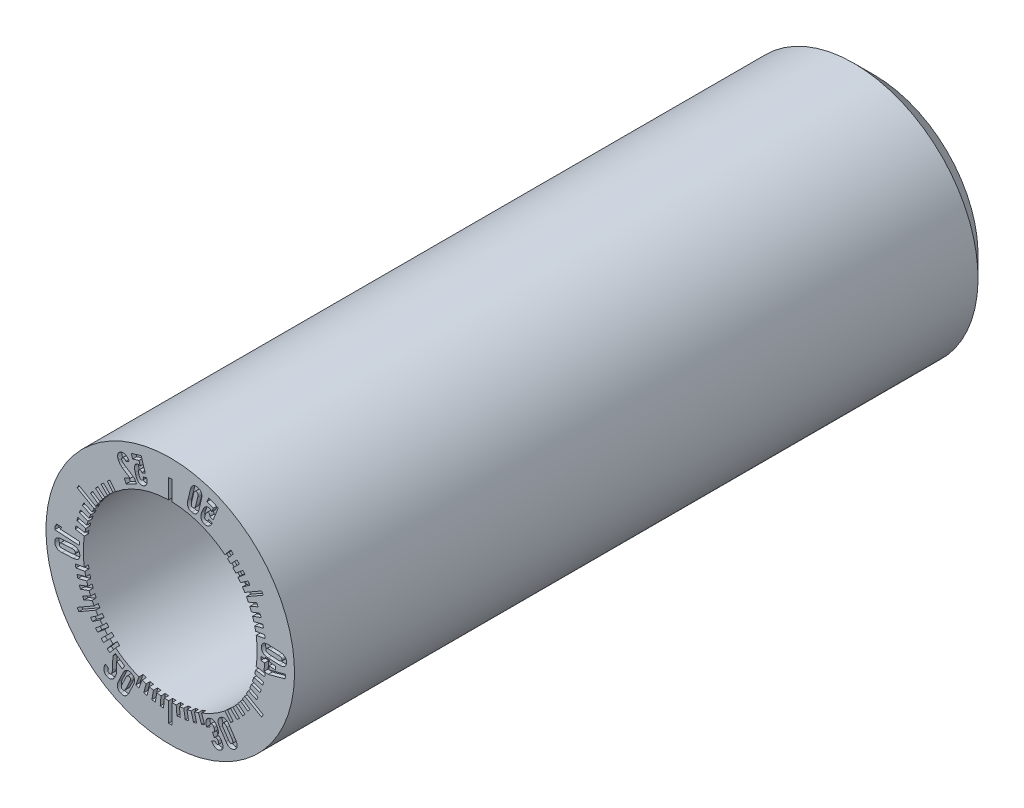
SolidWorks part; units mm, degrees
ref_plane "Front Plane" through (0, 0, 0) normal (0, 0, 1) x (1, 0, 0)
ref_plane "Top Plane" through (0, 0, 0) normal (0, 1, 0) x (1, 0, 0)
ref_plane "Right Plane" through (0, 0, 0) normal (1, 0, 0) x (0, 0, -1)
sketch "Sketch1" plane through (0, 0, 0) normal (1, 0, 0) x (0, 0, -1)
  line L0 (0, 0) -> (-75.4695, 0) construction
  line L2 (17, 1.5) -> (17, 2.5)
  line L4 (16.5, 3) -> (0, 3)
  line L5 (0, 3) -> (0, 2.1)
  line L7 (0, 2.1) -> (3, 2.1)
  line L8 (3, 2.1) -> (3, 0.8)
  line L9 (3, 0.8) -> (12, 0.8)
  line L10 (17, 1.5) -> (12, 1.5)
  line L11 (12, 0.8) -> (12, 1.5)
  line L12 (17, 2.5) -> (16.5, 3)
  point P6 (17, 3)
  dimension "D1" = 17
  dimension "D2" = 6
  dimension "D3" = 4.2
  dimension "D4" = 3
  dimension "D5" = 1.6
  dimension "D6" = 3
  dimension "D7" = 5
revolve "Revolve1" add sketch "Sketch1" angle 360 about L0
sketch "Sketch2" plane through (0, 0, 0) normal (0, 0, 1) x (1, 0, 0)
  line L0 (0, 0) -> (0, 3.6797) construction
  line L1 (2.2057, 1.3196) -> (2.2457, 1.2504)
  line L2 (-0.04, 2.57) -> (0.04, 2.57)
  line L3 (-0.04, 2.57) -> (-0.04, 2.09)
  line L4 (-0.04, 2.09) -> (0.04, 2.09)
  line L5 (0.04, 2.57) -> (0.04, 2.09)
  line L6 (2.2457, 1.2504) -> (1.83, 1.0104)
  line L7 (2.2057, 1.3196) -> (1.79, 1.0796)
  line L8 (1.79, 1.0796) -> (1.83, 1.0104)
  line L9 (-0.222, -2.0786) -> (-0.1423, -2.0855)
  line L10 (-0.1423, -2.0855) -> (-0.1624, -2.3147)
  line L11 (-0.222, -2.0786) -> (-0.242, -2.3077)
  line L12 (-0.242, -2.3077) -> (-0.1624, -2.3147)
  line L13 (2.2457, -1.2504) -> (2.2057, -1.3196)
  line L14 (2.2057, -1.3196) -> (1.79, -1.0796)
  line L15 (2.2457, -1.2504) -> (1.83, -1.0104)
  line L16 (1.83, -1.0104) -> (1.79, -1.0796)
  line L17 (0.04, -2.57) -> (-0.04, -2.57)
  line L18 (-0.04, -2.57) -> (-0.04, -2.09)
  line L19 (0.04, -2.57) -> (0.04, -2.09)
  line L20 (0.04, -2.09) -> (-0.04, -2.09)
  line L21 (-0.4023, -2.0513) -> (-0.3235, -2.0652)
  line L22 (-2.2057, -1.3196) -> (-2.2457, -1.2504)
  line L23 (-2.2457, -1.2504) -> (-1.83, -1.0104)
  line L24 (-2.2057, -1.3196) -> (-1.79, -1.0796)
  line L25 (-1.79, -1.0796) -> (-1.83, -1.0104)
  line L26 (-0.3235, -2.0652) -> (-0.3635, -2.2917)
  line L27 (-0.4023, -2.0513) -> (-0.4423, -2.2778)
  line L28 (-0.4423, -2.2778) -> (-0.3635, -2.2917)
  line L29 (-0.5796, -2.0084) -> (-0.5023, -2.0291)
  line L30 (-0.5023, -2.0291) -> (-0.5618, -2.2513)
  line L31 (-0.5796, -2.0084) -> (-0.6391, -2.2306)
  line L32 (-0.6391, -2.2306) -> (-0.5618, -2.2513)
  line L33 (-2.2457, 1.2504) -> (-2.2057, 1.3196)
  line L34 (-2.2057, 1.3196) -> (-1.79, 1.0796)
  line L35 (-0.7524, -1.9503) -> (-0.6772, -1.9776)
  line L36 (-0.6772, -1.9776) -> (-0.7559, -2.1938)
  line L37 (-0.7524, -1.9503) -> (-0.8311, -2.1664)
  line L38 (-0.8311, -2.1664) -> (-0.7559, -2.1938)
  line L39 (1.0126, 2.1395) -> (1.0127, 2.1398)
  line L40 (1.0127, 2.1398) -> (0.9315, 2.1728)
  line L41 (0.9315, 2.1728) -> (0.9313, 2.1724)
  line L42 (0.8419, 2.2135) -> (0.8605, 2.2593)
  line L43 (0.9573, 2.2485) -> (1.0332, 2.2176)
  line L44 (1.0332, 2.2176) -> (1.1606, 2.5315)
  line L45 (1.1606, 2.5315) -> (0.929, 2.6256)
  line L46 (0.929, 2.6256) -> (0.8888, 2.5265)
  line L47 (0.8888, 2.5265) -> (1.0392, 2.4654)
  line L48 (1.0392, 2.4654) -> (1, 2.3689)
  line L49 (0.7792, 2.2924) -> (0.7606, 2.2466)
  line L50 (0.6917, 2.2546) -> (0.7551, 2.5155)
  line L51 (-2.2457, 1.2504) -> (-1.83, 1.0104)
  line L52 (-1.3741, -1.5753) -> (-1.3128, -1.6267)
  line L53 (-1.3128, -1.6267) -> (-1.4606, -1.8029)
  line L54 (-1.3741, -1.5753) -> (-1.5219, -1.7515)
  line L55 (-1.5219, -1.7515) -> (-1.4606, -1.8029)
  line L56 (-1.5061, -1.4496) -> (-1.4496, -1.5061)
  line L57 (-1.4496, -1.5061) -> (-1.6122, -1.6688)
  line L58 (-1.5061, -1.4496) -> (-1.6688, -1.6122)
  line L59 (-1.6688, -1.6122) -> (-1.6122, -1.6688)
  line L60 (-1.6267, -1.3128) -> (-1.5753, -1.3741)
  line L61 (-1.5753, -1.3741) -> (-1.7515, -1.5219)
  line L62 (-1.6267, -1.3128) -> (-1.8029, -1.4606)
  line L63 (-1.8029, -1.4606) -> (-1.7515, -1.5219)
  line L64 (-1.735, -1.166) -> (-1.6891, -1.2315)
  line L65 (-1.6891, -1.2315) -> (-1.8775, -1.3635)
  line L66 (-1.735, -1.166) -> (-1.9234, -1.2979)
  line L67 (-1.9234, -1.2979) -> (-1.8775, -1.3635)
  line L68 (-1.83, 1.0104) -> (-1.79, 1.0796)
  line L69 (0.4869, 2.5806) -> (0.4235, 2.3197)
  line L70 (0.5149, 2.3269) -> (0.5648, 2.5325)
  line L71 (0.664, 2.5083) -> (0.6141, 2.3028)
  line L72 (-1.9111, -0.847) -> (-1.8773, -0.9195)
  line L73 (-1.8773, -0.9195) -> (-2.0857, -1.0167)
  line L74 (-1.9111, -0.847) -> (-2.1195, -0.9442)
  line L75 (-2.1195, -0.9442) -> (-2.0857, -1.0167)
  line L76 (-1.9776, -0.6772) -> (-1.9503, -0.7524)
  line L77 (-1.9503, -0.7524) -> (-2.1664, -0.8311)
  line L78 (-1.9776, -0.6772) -> (-2.1938, -0.7559)
  line L79 (-2.1938, -0.7559) -> (-2.1664, -0.8311)
  line L80 (-2.0291, -0.5023) -> (-2.0084, -0.5796)
  line L81 (-2.0084, -0.5796) -> (-2.2306, -0.6391)
  line L82 (-2.0291, -0.5023) -> (-2.2513, -0.5618)
  line L83 (-2.2513, -0.5618) -> (-2.2306, -0.6391)
  line L84 (-2.0652, -0.3235) -> (-2.0513, -0.4023)
  line L85 (-2.0513, -0.4023) -> (-2.2778, -0.4423)
  line L86 (-2.0652, -0.3235) -> (-2.2917, -0.3635)
  line L87 (-2.2917, -0.3635) -> (-2.2778, -0.4423)
  line L88 (-0.5693, 2.2975) -> (-0.5694, 2.2979)
  line L89 (-0.5694, 2.2979) -> (-0.6529, 2.2721)
  line L90 (-0.6529, 2.2721) -> (-0.6528, 2.2718)
  line L91 (-0.7476, 2.247) -> (-0.7621, 2.2943)
  line L92 (-0.6806, 2.347) -> (-0.6027, 2.3711)
  line L93 (-0.6027, 2.3711) -> (-0.7026, 2.6947)
  line L94 (-0.7026, 2.6947) -> (-0.9404, 2.6213)
  line L95 (-0.9404, 2.6213) -> (-0.9088, 2.5191)
  line L96 (-0.9088, 2.5191) -> (-0.7545, 2.5668)
  line L97 (-0.7545, 2.5668) -> (-0.7238, 2.4673)
  line L98 (-0.8454, 2.2685) -> (-0.8309, 2.2212)
  line L99 (-0.8568, 2.1323) -> (-1.1152, 2.3059)
  line L100 (-2.0513, 0.4023) -> (-2.0652, 0.3235)
  line L101 (-2.0652, 0.3235) -> (-2.2917, 0.3635)
  line L102 (-2.0513, 0.4023) -> (-2.2778, 0.4423)
  line L103 (-2.2778, 0.4423) -> (-2.2917, 0.3635)
  line L104 (-2.0084, 0.5796) -> (-2.0291, 0.5023)
  line L105 (-2.0291, 0.5023) -> (-2.2513, 0.5618)
  line L106 (-2.0084, 0.5796) -> (-2.2306, 0.6391)
  line L107 (-2.2306, 0.6391) -> (-2.2513, 0.5618)
  line L108 (-1.9503, 0.7524) -> (-1.9776, 0.6772)
  line L109 (-1.9776, 0.6772) -> (-2.1938, 0.7559)
  line L110 (-1.9503, 0.7524) -> (-2.1664, 0.8311)
  line L111 (-2.1664, 0.8311) -> (-2.1938, 0.7559)
  line L112 (-1.8773, 0.9195) -> (-1.9111, 0.847)
  line L113 (-1.9111, 0.847) -> (-2.1195, 0.9442)
  line L114 (-1.8773, 0.9195) -> (-2.0857, 1.0167)
  line L115 (-2.0857, 1.0167) -> (-2.1195, 0.9442)
  line L116 (-1.1664, 2.3616) -> (-1.1667, 2.3624)
  line L117 (-1.0696, 2.3864) -> (-1.0694, 2.3861)
  line L118 (-1.0694, 2.3861) -> (-0.9881, 2.4245)
  line L119 (-0.9881, 2.4245) -> (-0.9883, 2.4248)
  line L120 (-1.6891, 1.2315) -> (-1.735, 1.166)
  line L121 (-1.735, 1.166) -> (-1.9234, 1.2979)
  line L122 (-1.6891, 1.2315) -> (-1.8775, 1.3635)
  line L123 (-1.8775, 1.3635) -> (-1.9234, 1.2979)
  line L124 (-1.5753, 1.3741) -> (-1.6267, 1.3128)
  line L125 (-1.6267, 1.3128) -> (-1.8029, 1.4606)
  line L126 (-1.5753, 1.3741) -> (-1.7515, 1.5219)
  line L127 (-1.7515, 1.5219) -> (-1.8029, 1.4606)
  line L128 (-1.4496, 1.5061) -> (-1.5061, 1.4496)
  line L129 (0, 0) -> (0, -3.2841) construction
  line L130 (-1.5061, 1.4496) -> (-1.6688, 1.6122)
  line L131 (-1.4496, 1.5061) -> (-1.6122, 1.6688)
  line L132 (-1.6122, 1.6688) -> (-1.6688, 1.6122)
  line L133 (-1.3128, 1.6267) -> (-1.3741, 1.5753)
  line L134 (-1.3741, 1.5753) -> (-1.5219, 1.7515)
  line L135 (-1.3128, 1.6267) -> (-1.4606, 1.8029)
  line L136 (-1.4606, 1.8029) -> (-1.5219, 1.7515)
  line L137 (-1.2498, 2.3267) -> (-1.2496, 2.3264)
  line L138 (-1.1469, 2.2068) -> (-0.9649, 2.0892)
  line L139 (-0.9649, 2.0892) -> (-1.1087, 2.0213)
  line L140 (-1.1087, 2.0213) -> (-1.0628, 1.9241)
  line L141 (-1.0628, 1.9241) -> (-0.8139, 2.0413)
  line L142 (-0.8139, 2.0413) -> (-0.8568, 2.1323)
  line L143 (-2.1971, 0.0682) -> (-2.192, 0.1557)
  line L144 (-2.192, 0.1557) -> (-2.6514, 0.1825)
  line L145 (-2.6514, 0.1825) -> (-2.6208, 0.2374)
  line L146 (-2.6208, 0.2374) -> (-2.739, 0.2443)
  line L147 (-2.739, 0.2443) -> (-2.7828, 0.1773)
  line L148 (-2.7828, 0.1773) -> (-2.7871, 0.1025)
  line L149 (-2.7871, 0.1025) -> (-2.1971, 0.0682)
  line L150 (-2.3583, 0.0059) -> (-2.6266, -0.0094)
  line L151 (-2.6109, -0.2872) -> (-2.3426, -0.272)
  line L152 (-2.3761, -0.1861) -> (-2.5874, -0.1981)
  line L153 (-2.5933, -0.0953) -> (-2.3819, -0.0833)
  line L154 (-1.3836, -1.8346) -> (-1.398, -2.1453)
  line L155 (-1.4189, -2.2178) -> (-1.4193, -2.2183)
  line L156 (-1.4905, -2.1476) -> (-1.4902, -2.1472)
  line L157 (-1.4902, -2.1472) -> (-1.5653, -2.0974)
  line L158 (-1.5653, -2.0974) -> (-1.5655, -2.0978)
  line L159 (-1.3459, -2.2712) -> (-1.3456, -2.2708)
  line L160 (-1.2967, -2.1213) -> (-1.2906, -1.9048)
  line L161 (-1.2906, -1.9048) -> (-1.1579, -1.9931)
  line L162 (-1.1579, -1.9931) -> (-1.0984, -1.9036)
  line L163 (-1.0984, -1.9036) -> (-1.328, -1.7509)
  line L164 (-1.328, -1.7509) -> (-1.3836, -1.8346)
  line L165 (-1.1383, -2.0643) -> (-1.2534, -2.3052)
  line L166 (-1.0018, -2.4254) -> (-0.8868, -2.1845)
  line L167 (-0.9781, -2.1723) -> (-1.0688, -2.3621)
  line L168 (-1.162, -2.3176) -> (-1.0713, -2.1278)
  line L169 (0.8771, -2.1869) -> (0.959, -2.1478)
  line L170 (1.0548, -2.1131) -> (1.0607, -2.1255)
  line L171 (1.0524, -2.207) -> (1.0168, -2.224)
  line L172 (1.0168, -2.224) -> (1.0629, -2.3201)
  line L173 (1.0629, -2.3201) -> (1.0984, -2.3031)
  line L174 (1.156, -2.3426) -> (1.1604, -2.3517)
  line L175 (1.079, -2.3813) -> (0.9974, -2.4204)
  line L176 (1.2502, -2.3213) -> (1.2426, -2.3053)
  line L177 (1.142, -2.0772) -> (1.1344, -2.0612)
  line L178 (1.1933, -2.0345) -> (1.3428, -2.2582)
  line L179 (1.5751, -2.1029) -> (1.4257, -1.8792)
  line L180 (1.3683, -1.9518) -> (1.4862, -2.1282)
  line L181 (1.4001, -2.1857) -> (1.2823, -2.0093)
  line L182 (2.3652, -0.3458) -> (2.7739, -0.2354)
  line L183 (2.7739, -0.2354) -> (2.7821, -0.1363)
  line L184 (2.7821, -0.1363) -> (2.3786, -0.2433)
  line L185 (2.3786, -0.2433) -> (2.3855, -0.1588)
  line L186 (2.3957, -0.0348) -> (2.2886, -0.026)
  line L187 (2.2886, -0.026) -> (2.2856, -0.0624)
  line L188 (2.263, -0.3375) -> (2.3652, -0.3458)
  line L189 (2.5349, -0.1711) -> (2.5421, -0.0836)
  line L190 (2.5421, -0.0836) -> (2.3927, -0.0713)
  line L191 (2.1947, -0.0549) -> (2.1875, -0.1425)
  line L192 (2.1875, -0.1425) -> (2.2784, -0.15)
  line L193 (2.3636, -0.0013) -> (2.6325, -0.0147)
  line L194 (2.6464, 0.2638) -> (2.3776, 0.2772)
  line L195 (2.4017, 0.1881) -> (2.6136, 0.1774)
  line L196 (2.6085, 0.0744) -> (2.3966, 0.0851)
  line L197 (1.3741, 1.5753) -> (1.3128, 1.6267)
  line L198 (1.3128, 1.6267) -> (1.4606, 1.8029)
  line L199 (1.3741, 1.5753) -> (1.5219, 1.7515)
  line L200 (1.5219, 1.7515) -> (1.4606, 1.8029)
  line L201 (1.5061, 1.4496) -> (1.4496, 1.5061)
  line L202 (1.4496, 1.5061) -> (1.6122, 1.6688)
  line L203 (1.5061, 1.4496) -> (1.6688, 1.6122)
  line L204 (1.6688, 1.6122) -> (1.6122, 1.6688)
  line L205 (1.6267, 1.3128) -> (1.5753, 1.3741)
  line L206 (1.5753, 1.3741) -> (1.7515, 1.5219)
  line L207 (1.6267, 1.3128) -> (1.8029, 1.4606)
  line L208 (1.8029, 1.4606) -> (1.7515, 1.5219)
  line L209 (1.735, 1.166) -> (1.6891, 1.2315)
  line L210 (1.6891, 1.2315) -> (1.8775, 1.3635)
  line L211 (1.735, 1.166) -> (1.9234, 1.2979)
  line L212 (1.9234, 1.2979) -> (1.8775, 1.3635)
  line L213 (2.2856, -0.0624) -> (2.1947, -0.0549)
  line L214 (2.2784, -0.15) -> (2.263, -0.3375)
  line L215 (2.3927, -0.0713) -> (2.3957, -0.0348)
  line L216 (2.3855, -0.1588) -> (2.5349, -0.1711)
  line L217 (1.9111, 0.847) -> (1.8773, 0.9195)
  line L218 (1.8773, 0.9195) -> (2.0857, 1.0167)
  line L219 (1.9111, 0.847) -> (2.1195, 0.9442)
  line L220 (2.1195, 0.9442) -> (2.0857, 1.0167)
  line L221 (1.9776, 0.6772) -> (1.9503, 0.7524)
  line L222 (1.9503, 0.7524) -> (2.1664, 0.8311)
  line L223 (1.9776, 0.6772) -> (2.1938, 0.7559)
  line L224 (2.1938, 0.7559) -> (2.1664, 0.8311)
  line L225 (2.0291, 0.5023) -> (2.0084, 0.5796)
  line L226 (2.0084, 0.5796) -> (2.2306, 0.6391)
  line L227 (2.0291, 0.5023) -> (2.2513, 0.5618)
  line L228 (2.2513, 0.5618) -> (2.2306, 0.6391)
  line L229 (2.0652, 0.3235) -> (2.0513, 0.4023)
  line L230 (2.0513, 0.4023) -> (2.2778, 0.4423)
  line L231 (2.0652, 0.3235) -> (2.2917, 0.3635)
  line L232 (2.2917, 0.3635) -> (2.2778, 0.4423)
  line L245 (2.0513, -0.4023) -> (2.0652, -0.3235)
  line L246 (2.0652, -0.3235) -> (2.2917, -0.3635)
  line L247 (2.0513, -0.4023) -> (2.2778, -0.4423)
  line L248 (2.2778, -0.4423) -> (2.2917, -0.3635)
  line L249 (2.0084, -0.5796) -> (2.0291, -0.5023)
  line L250 (2.0291, -0.5023) -> (2.2513, -0.5618)
  line L251 (2.0084, -0.5796) -> (2.2306, -0.6391)
  line L252 (2.2306, -0.6391) -> (2.2513, -0.5618)
  line L253 (1.9503, -0.7524) -> (1.9776, -0.6772)
  line L254 (1.9776, -0.6772) -> (2.1938, -0.7559)
  line L255 (1.9503, -0.7524) -> (2.1664, -0.8311)
  line L256 (2.1664, -0.8311) -> (2.1938, -0.7559)
  line L257 (1.8773, -0.9195) -> (1.9111, -0.847)
  line L258 (1.9111, -0.847) -> (2.1195, -0.9442)
  line L259 (1.8773, -0.9195) -> (2.0857, -1.0167)
  line L260 (2.0857, -1.0167) -> (2.1195, -0.9442)
  line L265 (1.6891, -1.2315) -> (1.735, -1.166)
  line L266 (1.735, -1.166) -> (1.9234, -1.2979)
  line L267 (1.6891, -1.2315) -> (1.8775, -1.3635)
  line L268 (1.8775, -1.3635) -> (1.9234, -1.2979)
  line L269 (1.5753, -1.3741) -> (1.6267, -1.3128)
  line L270 (1.6267, -1.3128) -> (1.8029, -1.4606)
  line L271 (1.5753, -1.3741) -> (1.7515, -1.5219)
  line L272 (1.7515, -1.5219) -> (1.8029, -1.4606)
  line L273 (1.4496, -1.5061) -> (1.5061, -1.4496)
  line L274 (1.5061, -1.4496) -> (1.6688, -1.6122)
  line L275 (1.4496, -1.5061) -> (1.6122, -1.6688)
  line L276 (1.6122, -1.6688) -> (1.6688, -1.6122)
  line L277 (1.3128, -1.6267) -> (1.3741, -1.5753)
  line L278 (1.3741, -1.5753) -> (1.5219, -1.7515)
  line L279 (1.3128, -1.6267) -> (1.4606, -1.8029)
  line L280 (1.4606, -1.8029) -> (1.5219, -1.7515)
  line L293 (0.6772, -1.9776) -> (0.7524, -1.9503)
  line L294 (0.7524, -1.9503) -> (0.8311, -2.1664)
  line L295 (0.6772, -1.9776) -> (0.7559, -2.1938)
  line L296 (0.7559, -2.1938) -> (0.8311, -2.1664)
  line L297 (0.5023, -2.0291) -> (0.5796, -2.0084)
  line L298 (0.5796, -2.0084) -> (0.6391, -2.2306)
  line L299 (0.5023, -2.0291) -> (0.5618, -2.2513)
  line L300 (0.5618, -2.2513) -> (0.6391, -2.2306)
  line L301 (0.3235, -2.0652) -> (0.4023, -2.0513)
  line L302 (0.4023, -2.0513) -> (0.4423, -2.2778)
  line L303 (0.3235, -2.0652) -> (0.3635, -2.2917)
  line L304 (0.3635, -2.2917) -> (0.4423, -2.2778)
  line L305 (0.1423, -2.0855) -> (0.222, -2.0786)
  line L306 (0.222, -2.0786) -> (0.242, -2.3077)
  line L307 (0.1423, -2.0855) -> (0.1624, -2.3147)
  line L308 (0.1624, -2.3147) -> (0.242, -2.3077)
  circle A0 centre (0, 0) radius 2.2 construction
  spline S0 degree 3 poles (0.8198, 2.0274) (0.8309, 2.0229) (0.8485, 2.0183) (0.8725, 2.0184) (0.8904, 2.0209) (0.9081, 2.0263) (0.9253, 2.0348) (0.942, 2.0459) (0.9581, 2.0597) (0.9734, 2.0761) (0.9931, 2.102) (1.0054, 2.1239) (1.0126, 2.1395) knots 0 0 0 0 0.145629 0.217085 0.289467 0.363823 0.440349 0.520959 0.606365 0.696725 0.792102 1 1 1 1
  spline S1 degree 3 poles (0.9313, 2.1724) (0.9271, 2.1636) (0.9195, 2.1518) (0.9075, 2.1384) (0.8982, 2.1314) (0.8886, 2.1265) (0.8753, 2.1236) (0.8652, 2.1252) (0.8591, 2.1278) knots 0 0 0 0 0.312991 0.44747 0.570627 0.68364 0.788056 1 1 1 1
  spline S2 degree 3 poles (0.8591, 2.1278) (0.8526, 2.1304) (0.8437, 2.1365) (0.8362, 2.1485) (0.8329, 2.159) (0.8317, 2.171) (0.8335, 2.1897) (0.838, 2.2039) (0.8419, 2.2135) knots 0 0 0 0 0.214624 0.317977 0.427535 0.5492 0.682312 1 1 1 1
  spline S3 degree 3 poles (0.8605, 2.2593) (0.8644, 2.2688) (0.8707, 2.2823) (0.8821, 2.297) (0.8907, 2.305) (0.8997, 2.3103) (0.9122, 2.3144) (0.9221, 2.3128) (0.9279, 2.3104) knots 0 0 0 0 0.329173 0.466162 0.588662 0.698351 0.798671 1 1 1 1
  spline S4 degree 3 poles (0.9279, 2.3104) (0.9335, 2.3083) (0.941, 2.3034) (0.949, 2.2947) (0.9534, 2.2869) (0.9565, 2.2783) (0.959, 2.2654) (0.9582, 2.2553) (0.9573, 2.2485) knots 0 0 0 0 0.240245 0.355023 0.473973 0.59586 0.722024 1 1 1 1
  spline S5 degree 3 poles (1, 2.3689) (0.9983, 2.374) (0.9949, 2.3815) (0.9882, 2.3905) (0.9822, 2.397) (0.9756, 2.4032) (0.9661, 2.41) (0.9585, 2.4143) (0.9532, 2.4164) knots 0 0 0 0 0.232907 0.35742 0.487452 0.620741 0.749919 1 1 1 1
  spline S6 degree 3 poles (0.9532, 2.4164) (0.9427, 2.4205) (0.9261, 2.4249) (0.9038, 2.424) (0.8876, 2.4204) (0.8718, 2.4141) (0.8566, 2.4047) (0.8419, 2.3925) (0.8278, 2.3776) (0.8144, 2.36) (0.7967, 2.3321) (0.7859, 2.3087) (0.7792, 2.2924) knots 0 0 0 0 0.14204 0.2102 0.278275 0.348606 0.422261 0.501581 0.586913 0.678872 0.778296 1 1 1 1
  spline S7 degree 3 poles (0.7606, 2.2466) (0.7542, 2.2301) (0.7456, 2.2057) (0.74, 2.1729) (0.7385, 2.1503) (0.7397, 2.1292) (0.7432, 2.1094) (0.7498, 2.0913) (0.7586, 2.0747) (0.7703, 2.0599) (0.7896, 2.0422) (0.8072, 2.0324) (0.8198, 2.0274) knots 0 0 0 0 0.207219 0.300939 0.388369 0.470617 0.547977 0.62217 0.694941 0.767315 0.841383 1 1 1 1
  spline S8 degree 3 poles (0.518, 2.1242) (0.5283, 2.1217) (0.5438, 2.1192) (0.5641, 2.1191) (0.5783, 2.1207) (0.5919, 2.1238) (0.6049, 2.1285) (0.617, 2.1351) (0.6286, 2.1429) (0.6394, 2.1524) (0.6493, 2.1632) (0.6585, 2.1752) (0.6669, 2.1886) (0.6745, 2.2032) (0.6834, 2.2251) (0.6888, 2.2425) (0.6917, 2.2546) knots 0 0 0 0 0.129288 0.189012 0.247001 0.302666 0.358203 0.413902 0.47038 0.528574 0.58769 0.648588 0.712173 0.778943 0.848882 1 1 1 1
  spline S9 degree 3 poles (0.7551, 2.5155) (0.7582, 2.5276) (0.7614, 2.5457) (0.7633, 2.5695) (0.7636, 2.586) (0.7621, 2.6017) (0.7596, 2.6166) (0.7556, 2.6307) (0.7502, 2.6439) (0.7436, 2.6562) (0.7356, 2.6675) (0.7263, 2.6776) (0.7157, 2.6866) (0.7037, 2.6943) (0.6858, 2.7037) (0.6709, 2.7083) (0.6606, 2.7109) knots 0 0 0 0 0.152555 0.222885 0.28958 0.353124 0.414338 0.473292 0.531017 0.587519 0.642883 0.698387 0.754422 0.811742 0.8712 1 1 1 1
  spline S10 degree 3 poles (0.6606, 2.7109) (0.6503, 2.7135) (0.6349, 2.7159) (0.6145, 2.7161) (0.6003, 2.7146) (0.5868, 2.7116) (0.5739, 2.7068) (0.5617, 2.7005) (0.5502, 2.6927) (0.5394, 2.6835) (0.5294, 2.6727) (0.5202, 2.6608) (0.512, 2.6473) (0.5043, 2.6326) (0.4953, 2.6104) (0.4897, 2.5929) (0.4869, 2.5806) knots 0 0 0 0 0.129149 0.189243 0.246495 0.302472 0.357262 0.412782 0.468771 0.525998 0.585182 0.646015 0.709492 0.776677 0.847027 1 1 1 1
  spline S11 degree 3 poles (0.4235, 2.3197) (0.4204, 2.3076) (0.4172, 2.2895) (0.4153, 2.2657) (0.415, 2.2492) (0.4166, 2.2335) (0.419, 2.2186) (0.4231, 2.2045) (0.4284, 2.1913) (0.4351, 2.179) (0.4431, 2.1677) (0.4523, 2.1576) (0.463, 2.1487) (0.4749, 2.1408) (0.4929, 2.1315) (0.5078, 2.1269) (0.518, 2.1242) knots 0 0 0 0 0.152562 0.222896 0.289594 0.353141 0.414357 0.473315 0.531042 0.587547 0.642914 0.69842 0.753874 0.811733 0.871194 1 1 1 1
  spline S12 degree 3 poles (0.5433, 2.2284) (0.5356, 2.2301) (0.5245, 2.2355) (0.515, 2.2484) (0.5106, 2.2602) (0.5086, 2.2741) (0.5087, 2.2968) (0.5118, 2.3146) (0.5149, 2.3269) knots 0 0 0 0 0.20655 0.305065 0.41083 0.531717 0.668533 1 1 1 1
  spline S13 degree 3 poles (0.5648, 2.5325) (0.5681, 2.5447) (0.5729, 2.5622) (0.5836, 2.5821) (0.5916, 2.5935) (0.601, 2.602) (0.6154, 2.6091) (0.6277, 2.6087) (0.6353, 2.6068) knots 0 0 0 0 0.331526 0.468441 0.588018 0.69456 0.793838 1 1 1 1
  spline S14 degree 3 poles (0.6353, 2.6068) (0.643, 2.6051) (0.6541, 2.5997) (0.6637, 2.5868) (0.6682, 2.5749) (0.6704, 2.5611) (0.6703, 2.5384) (0.6669, 2.5207) (0.664, 2.5083) knots 0 0 0 0 0.206444 0.305849 0.412345 0.532333 0.669078 1 1 1 1
  spline S15 degree 3 poles (0.6141, 2.3028) (0.6111, 2.2904) (0.6058, 2.2732) (0.5954, 2.253) (0.5871, 2.2417) (0.5778, 2.2331) (0.5632, 2.2264) (0.551, 2.2263) (0.5433, 2.2284) knots 0 0 0 0 0.331056 0.467727 0.588299 0.69466 0.793572 1 1 1 1
  spline S16 degree 3 poles (-0.647, 2.089) (-0.6355, 2.0925) (-0.6193, 2.1003) (-0.6006, 2.1152) (-0.5887, 2.1286) (-0.5784, 2.1439) (-0.5704, 2.1613) (-0.5645, 2.1804) (-0.5609, 2.2012) (-0.5594, 2.2236) (-0.5607, 2.2561) (-0.565, 2.2809) (-0.5693, 2.2975) knots 0 0 0 0 0.145227 0.216025 0.288648 0.362693 0.439093 0.519844 0.605224 0.695708 0.791338 1 1 1 1
  spline S17 degree 3 poles (-0.6528, 2.2718) (-0.6507, 2.2622) (-0.6485, 2.2483) (-0.6496, 2.2304) (-0.6523, 2.2191) (-0.6567, 2.2094) (-0.6649, 2.1986) (-0.6737, 2.1934) (-0.6801, 2.1916) knots 0 0 0 0 0.313998 0.448349 0.571081 0.683382 0.78855 1 1 1 1
  spline S18 degree 3 poles (-0.6801, 2.1916) (-0.6868, 2.1895) (-0.6976, 2.1885) (-0.7109, 2.1932) (-0.7201, 2.1992) (-0.7285, 2.2078) (-0.7391, 2.2233) (-0.7444, 2.2372) (-0.7476, 2.247) knots 0 0 0 0 0.215045 0.31761 0.428122 0.549158 0.68289 1 1 1 1
  spline S19 degree 3 poles (-0.7621, 2.2943) (-0.7651, 2.3042) (-0.7686, 2.3185) (-0.7691, 2.3371) (-0.7675, 2.3486) (-0.764, 2.3585) (-0.757, 2.3694) (-0.7484, 2.3744) (-0.7424, 2.3763) knots 0 0 0 0 0.329547 0.467152 0.589298 0.699294 0.798546 1 1 1 1
  spline S20 degree 3 poles (-0.7424, 2.3763) (-0.7368, 2.378) (-0.7279, 2.3793) (-0.7163, 2.3773) (-0.708, 2.3744) (-0.7001, 2.3697) (-0.6901, 2.3612) (-0.6841, 2.353) (-0.6806, 2.347) knots 0 0 0 0 0.239083 0.353494 0.471595 0.593169 0.719161 1 1 1 1
  spline S21 degree 3 poles (-0.7238, 2.4673) (-0.7281, 2.4705) (-0.7357, 2.4736) (-0.7464, 2.4768) (-0.7552, 2.4779) (-0.7641, 2.4783) (-0.7758, 2.4778) (-0.7843, 2.4761) (-0.7897, 2.4744) knots 0 0 0 0 0.234108 0.357853 0.488707 0.62074 0.751178 1 1 1 1
  spline S22 degree 3 poles (-0.7897, 2.4744) (-0.8004, 2.471) (-0.8159, 2.464) (-0.8326, 2.4493) (-0.8429, 2.4363) (-0.8509, 2.4214) (-0.8569, 2.4045) (-0.8603, 2.3858) (-0.8618, 2.3653) (-0.861, 2.3432) (-0.857, 2.3104) (-0.8505, 2.2855) (-0.8454, 2.2685) knots 0 0 0 0 0.141697 0.209535 0.277428 0.34802 0.421419 0.500686 0.586179 0.678632 0.777785 1 1 1 1
  spline S23 degree 3 poles (-0.8309, 2.2212) (-0.8258, 2.2042) (-0.8163, 2.1803) (-0.8004, 2.1511) (-0.7873, 2.1329) (-0.7732, 2.1171) (-0.7578, 2.1043) (-0.7415, 2.0943) (-0.7241, 2.087) (-0.7057, 2.083) (-0.6797, 2.0813) (-0.6599, 2.0851) (-0.647, 2.089) knots 0 0 0 0 0.207805 0.301191 0.388577 0.470615 0.547781 0.62199 0.694947 0.767401 0.841349 1 1 1 1
  spline S24 degree 3 poles (-1.1152, 2.3059) (-1.1264, 2.3134) (-1.146, 2.33) (-1.1612, 2.3508) (-1.1664, 2.3616) knots 0 0 0 0 0.529595 1 1 1 1
  spline S25 degree 3 poles (-1.1667, 2.3624) (-1.1696, 2.3688) (-1.1732, 2.3787) (-1.1736, 2.3921) (-1.1718, 2.401) (-1.1682, 2.4092) (-1.1602, 2.4192) (-1.1519, 2.4247) (-1.1458, 2.4275) knots 0 0 0 0 0.276281 0.396764 0.512178 0.624234 0.740144 1 1 1 1
  spline S26 degree 3 poles (-1.1458, 2.4275) (-1.1397, 2.4307) (-1.1295, 2.4326) (-1.1158, 2.4306) (-1.1058, 2.4262) (-1.096, 2.4197) (-1.0828, 2.407) (-1.0745, 2.3952) (-1.0696, 2.3864) knots 0 0 0 0 0.211892 0.31726 0.428942 0.551462 0.684935 1 1 1 1
  spline S27 degree 3 poles (-0.9883, 2.4248) (-0.9965, 2.4401) (-1.01, 2.4615) (-1.031, 2.4866) (-1.0472, 2.5021) (-1.064, 2.5151) (-1.0815, 2.525) (-1.0993, 2.5324) (-1.1176, 2.5369) (-1.1362, 2.5383) (-1.1613, 2.5363) (-1.1795, 2.5305) (-1.1911, 2.5251) knots 0 0 0 0 0.20618 0.299719 0.388669 0.472666 0.552006 0.627422 0.701644 0.774935 0.847784 1 1 1 1
  spline S28 degree 3 poles (-1.1911, 2.5251) (-1.2033, 2.5192) (-1.2207, 2.5092) (-1.2396, 2.4915) (-1.251, 2.4773) (-1.26, 2.4619) (-1.2662, 2.4452) (-1.2701, 2.4276) (-1.271, 2.4089) (-1.2698, 2.3893) (-1.2641, 2.3612) (-1.2564, 2.3404) (-1.2498, 2.3267) knots 0 0 0 0 0.173466 0.252943 0.329718 0.404937 0.480033 0.556026 0.635156 0.718068 0.805679 1 1 1 1
  spline S29 degree 3 poles (-1.2496, 2.3264) (-1.2438, 2.3143) (-1.234, 2.2966) (-1.2185, 2.2744) (-1.2056, 2.2587) (-1.1921, 2.2437) (-1.1731, 2.2256) (-1.1577, 2.2138) (-1.1469, 2.2068) knots 0 0 0 0 0.252707 0.379472 0.507965 0.635168 0.759147 1 1 1 1
  spline S30 degree 3 poles (-2.1829, -0.1236) (-2.1835, -0.1129) (-2.1856, -0.0973) (-2.1914, -0.0776) (-2.197, -0.0643) (-2.2041, -0.0522) (-2.2124, -0.041) (-2.2222, -0.0312) (-2.2332, -0.0223) (-2.2453, -0.0146) (-2.2586, -0.0082) (-2.2727, -0.0027) (-2.288, 0.0013) (-2.3041, 0.0043) (-2.3277, 0.0064) (-2.3459, 0.0068) (-2.3583, 0.0059) knots 0 0 0 0 0.129785 0.189954 0.247693 0.304415 0.359686 0.415707 0.472335 0.530323 0.589027 0.650244 0.713424 0.779904 0.849396 1 1 1 1
  spline S31 degree 3 poles (-2.6266, -0.0094) (-2.6391, -0.0102) (-2.6574, -0.0121) (-2.6808, -0.0172) (-2.6966, -0.022) (-2.7113, -0.0278) (-2.7248, -0.0349) (-2.7372, -0.0428) (-2.7483, -0.0518) (-2.7582, -0.0618) (-2.7664, -0.0729) (-2.7736, -0.0847) (-2.779, -0.0976) (-2.7831, -0.1114) (-2.7865, -0.1315) (-2.787, -0.1472) (-2.7863, -0.1579) knots 0 0 0 0 0.152362 0.222101 0.288693 0.352588 0.413388 0.472388 0.529974 0.58618 0.641758 0.697148 0.753399 0.810782 0.870479 1 1 1 1
  spline S32 degree 3 poles (-2.7863, -0.1579) (-2.7858, -0.1686) (-2.7835, -0.1842) (-2.778, -0.2039) (-2.7723, -0.2171) (-2.7654, -0.2294) (-2.7572, -0.2404) (-2.7476, -0.2503) (-2.7368, -0.2592) (-2.7246, -0.2668) (-2.7115, -0.2733) (-2.6973, -0.2785) (-2.6821, -0.2829) (-2.6658, -0.2856) (-2.6419, -0.2881) (-2.6235, -0.2878) (-2.6109, -0.2872) knots 0 0 0 0 0.129655 0.189679 0.24736 0.303196 0.35883 0.413817 0.47005 0.527297 0.586204 0.647138 0.710436 0.777173 0.847173 1 1 1 1
  spline S33 degree 3 poles (-2.3426, -0.272) (-2.3301, -0.2712) (-2.3118, -0.2693) (-2.2885, -0.2642) (-2.2726, -0.2594) (-2.258, -0.2535) (-2.2445, -0.2465) (-2.2321, -0.2386) (-2.221, -0.2296) (-2.2112, -0.2196) (-2.2026, -0.2087) (-2.1958, -0.1967) (-2.1903, -0.1838) (-2.1861, -0.1701) (-2.1827, -0.15) (-2.1821, -0.1343) (-2.1829, -0.1236) knots 0 0 0 0 0.151971 0.222236 0.288869 0.352335 0.413173 0.47221 0.529831 0.586072 0.641671 0.697193 0.753056 0.810665 0.870399 1 1 1 1
  spline S34 degree 3 poles (-2.29, -0.1297) (-2.2896, -0.1376) (-2.2914, -0.1498) (-2.3009, -0.1629) (-2.311, -0.1706) (-2.3237, -0.1765) (-2.3453, -0.1835) (-2.3634, -0.1853) (-2.3761, -0.1861) knots 0 0 0 0 0.206429 0.305873 0.4124 0.532838 0.668721 1 1 1 1
  spline S35 degree 3 poles (-2.5874, -0.1981) (-2.6001, -0.1986) (-2.6183, -0.199) (-2.6406, -0.1946) (-2.6539, -0.1901) (-2.6646, -0.1835) (-2.6756, -0.1717) (-2.6788, -0.1597) (-2.6792, -0.1518) knots 0 0 0 0 0.331488 0.468205 0.587932 0.694654 0.792379 1 1 1 1
  spline S36 degree 3 poles (-2.6792, -0.1518) (-2.6795, -0.144) (-2.678, -0.1316) (-2.6683, -0.1187) (-2.6584, -0.1108) (-2.6456, -0.1049) (-2.6241, -0.0979) (-2.6059, -0.0961) (-2.5933, -0.0953) knots 0 0 0 0 0.207404 0.306093 0.412311 0.532767 0.668671 1 1 1 1
  spline S37 degree 3 poles (-2.3819, -0.0833) (-2.3692, -0.0826) (-2.351, -0.0827) (-2.3287, -0.0868) (-2.3155, -0.0913) (-2.3047, -0.0979) (-2.2937, -0.1098) (-2.2903, -0.1217) (-2.29, -0.1297) knots 0 0 0 0 0.33122 0.467434 0.586996 0.69357 0.792613 1 1 1 1
  spline S38 degree 3 poles (-1.398, -2.1453) (-1.3985, -2.1588) (-1.4026, -2.184) (-1.4122, -2.2078) (-1.4189, -2.2178) knots 0 0 0 0 0.530063 1 1 1 1
  spline S39 degree 3 poles (-1.4193, -2.2183) (-1.4233, -2.2243) (-1.4301, -2.2323) (-1.4412, -2.2398) (-1.4498, -2.2428) (-1.4587, -2.2439) (-1.4714, -2.2422) (-1.4804, -2.2379) (-1.486, -2.2341) knots 0 0 0 0 0.276237 0.397001 0.511354 0.623691 0.739101 1 1 1 1
  spline S40 degree 3 poles (-1.486, -2.2341) (-1.4917, -2.2304) (-1.4988, -2.2228) (-1.5041, -2.2101) (-1.5057, -2.1993) (-1.5052, -2.1875) (-1.5012, -2.1696) (-1.4953, -2.1564) (-1.4905, -2.1476) knots 0 0 0 0 0.212206 0.316428 0.42881 0.550716 0.685169 1 1 1 1
  spline S41 degree 3 poles (-1.5655, -2.0978) (-1.5741, -2.1128) (-1.5859, -2.1353) (-1.596, -2.1664) (-1.6011, -2.1882) (-1.6033, -2.2093) (-1.603, -2.2294) (-1.5999, -2.2485) (-1.5941, -2.2664) (-1.586, -2.2831) (-1.571, -2.3035) (-1.5568, -2.3163) (-1.5459, -2.3233) knots 0 0 0 0 0.205826 0.299741 0.388595 0.472187 0.551119 0.627055 0.701176 0.77424 0.847175 1 1 1 1
  spline S42 degree 3 poles (-1.5459, -2.3233) (-1.5346, -2.3308) (-1.5169, -2.3401) (-1.492, -2.3474) (-1.4739, -2.3499) (-1.4561, -2.3495) (-1.4386, -2.3465) (-1.4216, -2.3404) (-1.4049, -2.3319) (-1.389, -2.3205) (-1.3678, -2.3014) (-1.3544, -2.2837) (-1.3459, -2.2712) knots 0 0 0 0 0.174055 0.253493 0.330628 0.406059 0.480621 0.556572 0.635695 0.718591 0.80656 1 1 1 1
  spline S43 degree 3 poles (-1.3456, -2.2708) (-1.3383, -2.2596) (-1.3282, -2.2421) (-1.3173, -2.2174) (-1.3104, -2.1983) (-1.3047, -2.1789) (-1.2992, -2.1534) (-1.2972, -2.1341) (-1.2967, -2.1213) knots 0 0 0 0 0.252677 0.379806 0.508075 0.635332 0.75956 1 1 1 1
  spline S44 degree 3 poles (-0.9406, -1.9741) (-0.9503, -1.9694) (-0.9651, -1.9638) (-0.9851, -1.9593) (-0.9995, -1.9579) (-1.0135, -1.9581) (-1.0272, -1.96) (-1.0406, -1.9637) (-1.0536, -1.9689) (-1.0661, -1.9759) (-1.0782, -1.9842) (-1.0896, -1.994) (-1.1006, -2.0052) (-1.1108, -2.018) (-1.1244, -2.0372) (-1.1329, -2.0532) (-1.1383, -2.0643) knots 0 0 0 0 0.13043 0.191041 0.249233 0.305437 0.361138 0.416959 0.473489 0.531373 0.590456 0.650855 0.714095 0.780278 0.849641 1 1 1 1
  spline S45 degree 3 poles (-1.2534, -2.3052) (-1.2588, -2.3165) (-1.2657, -2.3334) (-1.2723, -2.3562) (-1.2758, -2.3723) (-1.2776, -2.3879) (-1.2781, -2.403) (-1.277, -2.4176) (-1.2743, -2.4316) (-1.2702, -2.445) (-1.2647, -2.4577) (-1.2574, -2.4694) (-1.2488, -2.4805) (-1.2387, -2.4907) (-1.2227, -2.5035) (-1.209, -2.5114) (-1.1993, -2.5159) knots 0 0 0 0 0.151392 0.221281 0.28767 0.350954 0.411674 0.470766 0.528215 0.584753 0.640208 0.69565 0.751591 0.809762 0.869956 1 1 1 1
  spline S46 degree 3 poles (-1.1993, -2.5159) (-1.1897, -2.5206) (-1.1749, -2.5263) (-1.1549, -2.5307) (-1.1406, -2.5323) (-1.1266, -2.5321) (-1.113, -2.5302) (-1.0996, -2.5267) (-1.0867, -2.5215) (-1.0742, -2.5147) (-1.0623, -2.5064) (-1.0507, -2.4966) (-1.0399, -2.4852) (-1.0295, -2.4724) (-1.0159, -2.4529) (-1.0072, -2.4367) (-1.0018, -2.4254) knots 0 0 0 0 0.130248 0.190775 0.248541 0.304284 0.359908 0.415405 0.471391 0.528715 0.587231 0.648032 0.711724 0.777816 0.847683 1 1 1 1
  spline S47 degree 3 poles (-0.8868, -2.1845) (-0.8815, -2.1732) (-0.8743, -2.1564) (-0.8677, -2.1336) (-0.8642, -2.1175) (-0.8624, -2.1019) (-0.862, -2.0869) (-0.863, -2.0723) (-0.8656, -2.0583) (-0.8698, -2.0449) (-0.8753, -2.0322) (-0.8826, -2.0205) (-0.8911, -2.0094) (-0.9014, -1.9994) (-0.9173, -1.9866) (-0.931, -1.9787) (-0.9406, -1.9741) knots 0 0 0 0 0.151307 0.221271 0.287732 0.351085 0.411871 0.470626 0.528137 0.584737 0.640252 0.695754 0.751755 0.809556 0.869816 1 1 1 1
  spline S48 degree 3 poles (-0.9866, -2.0702) (-0.9794, -2.0735) (-0.9696, -2.0811) (-0.9627, -2.0957) (-0.9607, -2.1081) (-0.9614, -2.1221) (-0.9659, -2.1442) (-0.9727, -2.1609) (-0.9781, -2.1723) knots 0 0 0 0 0.207839 0.307691 0.413844 0.53307 0.669525 1 1 1 1
  spline S49 degree 3 poles (-1.0688, -2.3621) (-1.0743, -2.3734) (-1.0829, -2.3893) (-1.0973, -2.4067) (-1.1077, -2.416) (-1.1187, -2.4222) (-1.1343, -2.4261) (-1.1464, -2.4233) (-1.1534, -2.4197) knots 0 0 0 0 0.330105 0.466405 0.586663 0.692852 0.792422 1 1 1 1
  spline S50 degree 3 poles (-1.1534, -2.4197) (-1.1607, -2.4164) (-1.1705, -2.4088) (-1.1774, -2.3942) (-1.1795, -2.3817) (-1.1788, -2.3677) (-1.1741, -2.3457) (-1.1674, -2.329) (-1.162, -2.3176) knots 0 0 0 0 0.208646 0.308411 0.414472 0.535068 0.670735 1 1 1 1
  spline S51 degree 3 poles (-1.0713, -2.1278) (-1.0661, -2.1163) (-1.0571, -2.1007) (-1.0429, -2.0832) (-1.0324, -2.0739) (-1.0215, -2.0677) (-1.0058, -2.0637) (-0.9937, -2.0668) (-0.9866, -2.0702) knots 0 0 0 0 0.330939 0.466109 0.586274 0.692382 0.791875 1 1 1 1
  spline S52 degree 3 poles (0.941, -1.9742) (0.9288, -1.9799) (0.9119, -1.9907) (0.8929, -2.0088) (0.8811, -2.024) (0.8716, -2.0406) (0.8644, -2.0585) (0.8601, -2.0778) (0.858, -2.0981) (0.8587, -2.1194) (0.863, -2.1498) (0.871, -2.1721) (0.8771, -2.1869) knots 0 0 0 0 0.162702 0.239769 0.316724 0.393176 0.470166 0.548727 0.630867 0.716684 0.805714 1 1 1 1
  spline S53 degree 3 poles (0.959, -2.1478) (0.9571, -2.1424) (0.9549, -2.1344) (0.9535, -2.1237) (0.9532, -2.1142) (0.9547, -2.1031) (0.9613, -2.0872) (0.9712, -2.0786) (0.9788, -2.0752) knots 0 0 0 0 0.206362 0.298527 0.387886 0.549536 0.699893 1 1 1 1
  spline S54 degree 3 poles (0.9788, -2.0752) (0.9856, -2.0719) (0.9965, -2.0689) (1.0113, -2.0702) (1.0216, -2.0741) (1.0312, -2.0804) (1.0437, -2.0927) (1.0506, -2.1046) (1.0548, -2.1131) knots 0 0 0 0 0.235572 0.344867 0.457219 0.575475 0.702326 1 1 1 1
  spline S55 degree 3 poles (1.0607, -2.1255) (1.0649, -2.1345) (1.0703, -2.1477) (1.0734, -2.1653) (1.0736, -2.1766) (1.0714, -2.1866) (1.0659, -2.1983) (1.058, -2.2043) (1.0524, -2.207) knots 0 0 0 0 0.325479 0.461992 0.583188 0.692815 0.793624 1 1 1 1
  spline S56 degree 3 poles (1.0984, -2.3031) (1.1031, -2.301) (1.1111, -2.2992) (1.1214, -2.302) (1.1291, -2.3062) (1.1364, -2.3126) (1.1463, -2.3243) (1.1522, -2.335) (1.156, -2.3426) knots 0 0 0 0 0.199062 0.299368 0.409433 0.533145 0.671416 1 1 1 1
  spline S57 degree 3 poles (1.1604, -2.3517) (1.1635, -2.3591) (1.1682, -2.3698) (1.1699, -2.3843) (1.1697, -2.3937) (1.1674, -2.4021) (1.1619, -2.4119) (1.1551, -2.4171) (1.15, -2.4194) knots 0 0 0 0 0.313929 0.446516 0.567131 0.677705 0.782242 1 1 1 1
  spline S58 degree 3 poles (1.15, -2.4194) (1.1466, -2.4212) (1.1409, -2.4227) (1.1331, -2.4228) (1.1271, -2.422) (1.121, -2.4201) (1.1148, -2.4173) (1.1087, -2.4136) (1.1025, -2.4089) (1.0964, -2.4033) (1.088, -2.3944) (1.0826, -2.3867) (1.079, -2.3813) knots 0 0 0 0 0.131237 0.197306 0.266085 0.338524 0.41488 0.496375 0.584017 0.678619 0.77947 1 1 1 1
  spline S59 degree 3 poles (0.9974, -2.4204) (1.0058, -2.4351) (1.0197, -2.4556) (1.041, -2.4795) (1.0577, -2.4941) (1.0747, -2.5064) (1.0923, -2.5158) (1.1103, -2.5225) (1.1284, -2.5265) (1.1467, -2.5278) (1.1709, -2.5258) (1.1883, -2.5201) (1.1993, -2.5149) knots 0 0 0 0 0.205126 0.299292 0.388994 0.473909 0.554242 0.630789 0.705935 0.779711 0.85171 1 1 1 1
  spline S60 degree 3 poles (1.1993, -2.5149) (1.2081, -2.5107) (1.2207, -2.5036) (1.2353, -2.4918) (1.2446, -2.4824) (1.2527, -2.4724) (1.2595, -2.4616) (1.2648, -2.45) (1.2688, -2.4377) (1.2714, -2.4248) (1.2725, -2.4114) (1.2724, -2.3975) (1.2707, -2.3831) (1.2677, -2.3683) (1.2616, -2.3473) (1.255, -2.3318) (1.2502, -2.3213) knots 0 0 0 0 0.128966 0.189013 0.24694 0.302987 0.358929 0.414586 0.47115 0.528852 0.587512 0.648712 0.711899 0.777974 0.848234 1 1 1 1
  spline S61 degree 3 poles (1.2426, -2.3053) (1.237, -2.2938) (1.2273, -2.2775) (1.2108, -2.2592) (1.1975, -2.248) (1.1832, -2.239) (1.1629, -2.2303) (1.1466, -2.2275) (1.1357, -2.2275) knots 0 0 0 0 0.275437 0.403658 0.52778 0.648458 0.765766 1 1 1 1
  spline S62 degree 3 poles (1.1357, -2.2275) (1.1444, -2.22) (1.1546, -2.2057) (1.162, -2.1832) (1.1642, -2.1644) (1.1634, -2.1442) (1.1577, -2.1142) (1.1492, -2.092) (1.142, -2.0772) knots 0 0 0 0 0.211305 0.319374 0.435625 0.561121 0.694601 1 1 1 1
  spline S63 degree 3 poles (1.1344, -2.0612) (1.1275, -2.0468) (1.116, -2.0266) (1.0973, -2.0032) (1.0827, -1.9889) (1.0672, -1.9772) (1.0509, -1.9682) (1.0338, -1.962) (1.016, -1.9588) (0.9977, -1.9583) (0.972, -1.9615) (0.9533, -1.9686) (0.941, -1.9742) knots 0 0 0 0 0.198329 0.288291 0.372609 0.453105 0.529255 0.603836 0.678283 0.753831 0.831569 1 1 1 1
  spline S64 degree 3 poles (1.2162, -1.8172) (1.2073, -1.8232) (1.1947, -1.8328) (1.1808, -1.848) (1.1721, -1.8596) (1.1651, -1.8718) (1.1598, -1.8847) (1.156, -1.8981) (1.1542, -1.9121) (1.1537, -1.9264) (1.1548, -1.9411) (1.1575, -1.9561) (1.1614, -1.9714) (1.1673, -1.9868) (1.1771, -2.0084) (1.1865, -2.0241) (1.1933, -2.0345) knots 0 0 0 0 0.130196 0.190569 0.24848 0.304649 0.360347 0.415975 0.472478 0.530411 0.589543 0.650277 0.713532 0.780028 0.849591 1 1 1 1
  spline S65 degree 3 poles (1.3428, -2.2582) (1.3498, -2.2686) (1.3608, -2.2835) (1.3772, -2.3009) (1.3892, -2.3123) (1.4018, -2.3219) (1.4146, -2.3299) (1.4278, -2.3367) (1.4413, -2.3415) (1.4549, -2.345) (1.4687, -2.3466) (1.4825, -2.3466) (1.4965, -2.3447) (1.5104, -2.3412) (1.5297, -2.334) (1.5435, -2.3263) (1.5524, -2.3203) knots 0 0 0 0 0.152058 0.222196 0.288776 0.351905 0.41274 0.471914 0.529528 0.585761 0.641042 0.696559 0.752478 0.810236 0.870141 1 1 1 1
  spline S66 degree 3 poles (1.5524, -2.3203) (1.5613, -2.3143) (1.5739, -2.3046) (1.5878, -2.2896) (1.5964, -2.278) (1.6036, -2.2659) (1.609, -2.2532) (1.6126, -2.2398) (1.6148, -2.226) (1.6153, -2.2116) (1.6142, -2.197) (1.6116, -2.182) (1.6074, -2.1668) (1.6016, -2.1512) (1.5915, -2.1294) (1.5822, -2.1134) (1.5751, -2.1029) knots 0 0 0 0 0.129992 0.189816 0.247167 0.303313 0.358926 0.413986 0.470168 0.527388 0.586427 0.647066 0.710515 0.776907 0.847398 1 1 1 1
  spline S67 degree 3 poles (1.4257, -1.8792) (1.4186, -1.8688) (1.4076, -1.854) (1.3914, -1.8365) (1.3792, -1.8252) (1.3666, -1.8157) (1.3539, -1.8074) (1.3406, -1.8009) (1.3272, -1.7958) (1.3135, -1.7926) (1.2998, -1.7909) (1.2859, -1.7909) (1.272, -1.7928) (1.258, -1.7962) (1.2389, -1.8036) (1.2251, -1.8111) (1.2162, -1.8172) knots 0 0 0 0 0.152227 0.222002 0.288489 0.352156 0.413142 0.471865 0.529524 0.585892 0.641702 0.696833 0.753234 0.810379 0.870681 1 1 1 1
  spline S68 degree 3 poles (1.2759, -1.9065) (1.2824, -1.902) (1.2939, -1.8973) (1.31, -1.899) (1.3218, -1.9037) (1.3336, -1.9115) (1.3502, -1.9269) (1.3612, -1.9413) (1.3683, -1.9518) knots 0 0 0 0 0.207103 0.306052 0.413142 0.533612 0.669375 1 1 1 1
  spline S69 degree 3 poles (1.4862, -2.1282) (1.4933, -2.1388) (1.5024, -2.1545) (1.5102, -2.1758) (1.513, -2.1896) (1.5127, -2.2022) (1.5082, -2.2178) (1.4993, -2.2265) (1.4928, -2.231) knots 0 0 0 0 0.331175 0.466657 0.58692 0.693525 0.792745 1 1 1 1
  spline S70 degree 3 poles (1.4928, -2.231) (1.4862, -2.2355) (1.4746, -2.2402) (1.4584, -2.2385) (1.4466, -2.2339) (1.4349, -2.2261) (1.4182, -2.2106) (1.4072, -2.1963) (1.4001, -2.1857) knots 0 0 0 0 0.208263 0.307067 0.414001 0.534295 0.669859 1 1 1 1
  spline S71 degree 3 poles (1.2823, -2.0093) (1.2753, -1.9987) (1.2659, -1.9832) (1.2583, -1.9618) (1.2555, -1.948) (1.2558, -1.9353) (1.2604, -1.9197) (1.2692, -1.9108) (1.2759, -1.9065) knots 0 0 0 0 0.329968 0.46601 0.586084 0.692521 0.791585 1 1 1 1
  spline S72 degree 3 poles (2.2026, 0.1465) (2.2019, 0.1357) (2.2026, 0.1199) (2.2063, 0.0997) (2.2106, 0.0859) (2.2161, 0.0729) (2.2234, 0.0611) (2.2319, 0.0502) (2.2419, 0.0402) (2.2532, 0.0313) (2.2657, 0.0234) (2.2793, 0.0166) (2.294, 0.0109) (2.3098, 0.0063) (2.333, 0.0011) (2.3512, -0.0006) (2.3636, -0.0013) knots 0 0 0 0 0.12999 0.190197 0.248293 0.304376 0.359835 0.415334 0.472018 0.530011 0.589191 0.650167 0.713499 0.779688 0.849209 1 1 1 1
  spline S73 degree 3 poles (2.6325, -0.0147) (2.6451, -0.0154) (2.6635, -0.0153) (2.6873, -0.0127) (2.7036, -0.0096) (2.7188, -0.0053) (2.733, 0.0001) (2.7462, 0.0067) (2.7582, 0.0146) (2.7691, 0.0234) (2.7786, 0.0335) (2.7869, 0.0446) (2.7937, 0.0569) (2.7993, 0.0702) (2.8048, 0.0899) (2.8071, 0.1054) (2.8075, 0.1162) knots 0 0 0 0 0.15224 0.222117 0.289032 0.352359 0.413032 0.472261 0.52993 0.58612 0.641621 0.696884 0.753172 0.810845 0.870559 1 1 1 1
  spline S74 degree 3 poles (2.8075, 0.1162) (2.8081, 0.1269) (2.8075, 0.1427) (2.8041, 0.1629) (2.7997, 0.1767) (2.7943, 0.1896) (2.7872, 0.2015) (2.7787, 0.2124) (2.7688, 0.2224) (2.7576, 0.2312) (2.7452, 0.2391) (2.7316, 0.2459) (2.7169, 0.2517) (2.7009, 0.2563) (2.6775, 0.2613) (2.659, 0.2631) (2.6464, 0.2638) knots 0 0 0 0 0.129726 0.18971 0.247297 0.303725 0.358513 0.413946 0.470177 0.527684 0.586352 0.647254 0.71051 0.777096 0.847459 1 1 1 1
  spline S75 degree 3 poles (2.3776, 0.2772) (2.365, 0.2779) (2.3466, 0.2778) (2.3228, 0.2752) (2.3066, 0.272) (2.2912, 0.268) (2.2771, 0.2624) (2.2639, 0.2559) (2.2519, 0.2481) (2.241, 0.2392) (2.2315, 0.2291) (2.2232, 0.218) (2.2164, 0.2057) (2.2108, 0.1924) (2.2053, 0.1727) (2.203, 0.1572) (2.2026, 0.1465) knots 0 0 0 0 0.152284 0.222181 0.288656 0.352256 0.41318 0.472426 0.529795 0.586001 0.641519 0.696797 0.753101 0.810791 0.870522 1 1 1 1
  spline S76 degree 3 poles (2.31, 0.1411) (2.3105, 0.149) (2.3136, 0.1611) (2.3245, 0.173) (2.3353, 0.1797) (2.3485, 0.1843) (2.3708, 0.1887) (2.389, 0.1885) (2.4017, 0.1881) knots 0 0 0 0 0.207079 0.306512 0.412683 0.532608 0.668983 1 1 1 1
  spline S77 degree 3 poles (2.6136, 0.1774) (2.6263, 0.1768) (2.6444, 0.1749) (2.6661, 0.1683) (2.6789, 0.1623) (2.689, 0.1547) (2.6986, 0.1417) (2.7007, 0.1294) (2.7001, 0.1215) knots 0 0 0 0 0.33067 0.467619 0.586851 0.693917 0.793094 1 1 1 1
  spline S78 degree 3 poles (2.7001, 0.1215) (2.6997, 0.1136) (2.6967, 0.1014) (2.6857, 0.0896) (2.6749, 0.0829) (2.6616, 0.0783) (2.6394, 0.0737) (2.6212, 0.0741) (2.6085, 0.0744) knots 0 0 0 0 0.207944 0.306478 0.412602 0.532473 0.669131 1 1 1 1
  spline S79 degree 3 poles (2.3966, 0.0851) (2.3839, 0.0857) (2.3658, 0.0876) (2.344, 0.0942) (2.3313, 0.1002) (2.3212, 0.1079) (2.3115, 0.1208) (2.3097, 0.1332) (2.31, 0.1411) knots 0 0 0 0 0.330405 0.467244 0.587693 0.693778 0.792128 1 1 1 1
  point P29 (0, -0.09)
  point P75 (0, 0)
  point P316 (0, 0)
  dimension "D1" = 4.4
  dimension "D5" = 0.04
  dimension "D7" = 0.08
  dimension "D8" = 0.48
  dimension "D9" = 2.09
extrude "Cut-Extrude1" cut sketch "Sketch2" against normal blind 0.1
